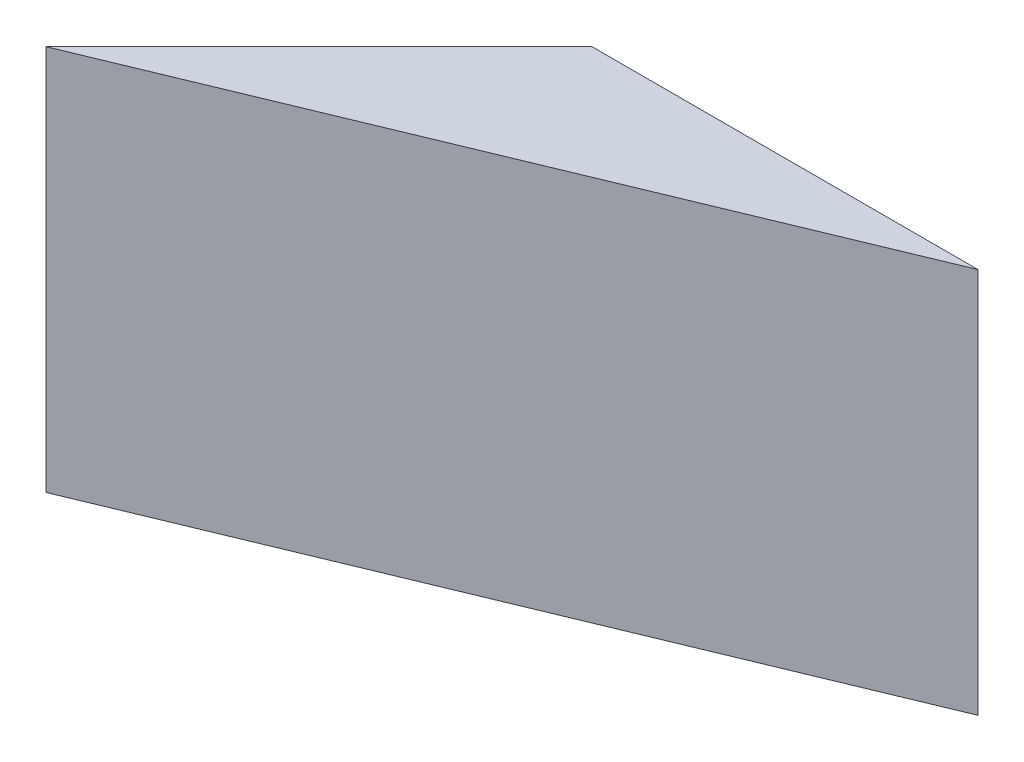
SolidWorks part; units mm, degrees
ref_plane "前视基准面" through (0, 0, 0) normal (0, 0, 1) x (1, 0, 0)
ref_plane "上视基准面" through (0, 0, 0) normal (0, 1, 0) x (1, 0, 0)
ref_plane "右视基准面" through (0, 0, 0) normal (1, 0, 0) x (0, 0, -1)
other "Configuration Table"
sketch "草图1" plane through (0, 0, 0) normal (0, 1, 0) x (1, 0, 0)
  line L0 (0, 0) -> (60, 0)
  line L1 (0, 0) -> (-42.4264, -42.4264)
  line L2 (-42.4264, -42.4264) -> (60, 0)
extrude "凸台-拉伸1" add sketch "草图1" along normal blind 60
